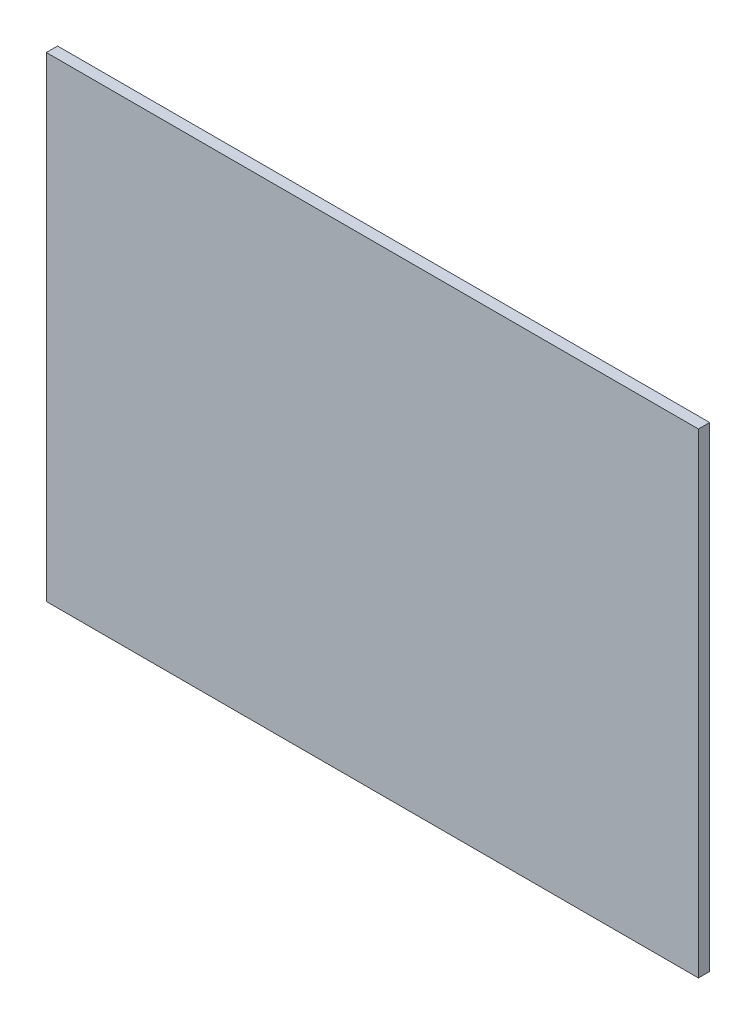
SolidWorks part; units mm, degrees
ref_plane "Plan de face" through (0, 0, 0) normal (0, 0, 1) x (1, 0, 0)
ref_plane "Plan de dessus" through (0, 0, 0) normal (0, 1, 0) x (1, 0, 0)
ref_plane "Plan de droite" through (0, 0, 0) normal (1, 0, 0) x (0, 0, -1)
sketch "Esquisse1" plane through (0, 0, 0) normal (0, 0, 1) x (1, 0, 0)
  line L0 (-63.5166, 14.9803) -> (-63.5166, -407.8997)
  line L1 (-73.5166, 14.9803) -> (526.4834, 14.9803)
  line L3 (-73.5166, -407.8997) -> (526.4834, -407.8997)
  line L4 (526.4834, 14.9803) -> (526.4834, -407.8997)
  line L5 (-73.5166, 14.9803) -> (-63.5166, 14.9803)
  line L8 (-63.5166, 14.9803) -> (-63.5166, 4.9803)
  line L9 (526.4834, 14.9803) -> (516.4834, 14.9803)
  line L10 (526.4834, 14.9803) -> (526.4834, 4.9803)
  line L11 (526.4834, 4.9803) -> (516.4834, 4.9803)
  line L12 (516.4834, 14.9803) -> (516.4834, 4.9803)
  line L13 (526.4834, -407.8997) -> (516.4834, -407.8997)
  line L14 (526.4834, -407.8997) -> (526.4834, -397.8997)
  line L15 (526.4834, -397.8997) -> (516.4834, -397.8997)
  line L16 (516.4834, -407.8997) -> (516.4834, -397.8997)
  line L17 (-73.5166, -407.8997) -> (-63.5166, -407.8997)
  line L18 (-73.5166, -407.8997) -> (-73.5166, -397.8997)
  line L19 (-73.5166, -397.8997) -> (-63.5166, -397.8997)
  line L20 (-63.5166, -407.8997) -> (-63.5166, -397.8997)
  line L21 (516.4834, 14.9803) -> (516.4834, -407.8997)
  dimension "D1" = 422.88
  dimension "D2" = 600
  dimension "D4" = 10
  dimension "D5" = 10
  dimension "D6" = 10
  dimension "D7" = 10
  dimension "D8" = 10
  dimension "D9" = 10
  dimension "D10" = 10
extrude "Boss.-Extru.1" add sketch "Esquisse1" along normal blind 10
